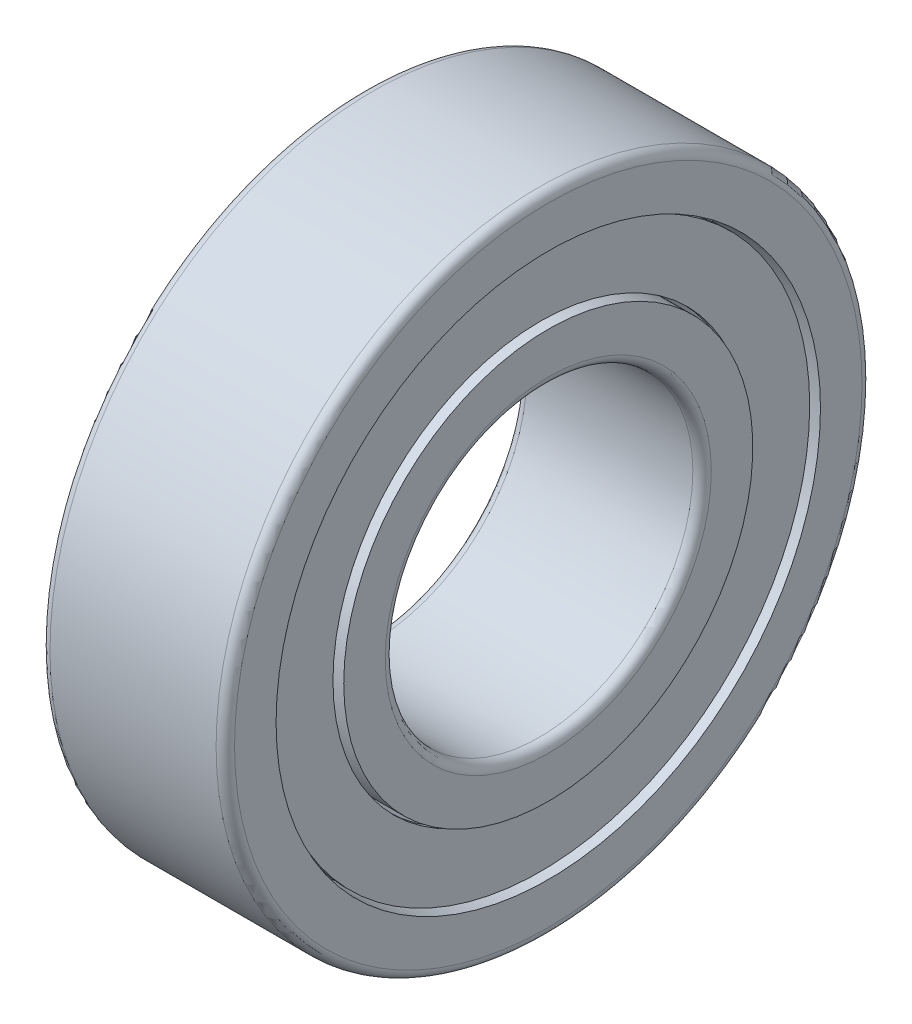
SolidWorks part; units mm, degrees
ref_plane "Plan de face" through (0, 0, 0) normal (0, 0, 1) x (1, 0, 0)
ref_plane "Plan de dessus" through (0, 0, 0) normal (0, 1, 0) x (1, 0, 0)
ref_plane "Plan de droite" through (0, 0, 0) normal (1, 0, 0) x (0, 0, -1)
imported_body "BAGUE INTERIEUR"
imported_body "BAGUE EXTERIEUR"
sketch "Esquisse2" plane through (0, 0, 0) normal (0, 0, 1) x (1, 0, 0)
  line L0 (0, 0) -> (14.2169, 0) construction
  line L1 (3.5403, 17.7) -> (0, 17.7) construction
  line L2 (0.5, 17.5) -> (0.8, 17.5)
  line L3 (0.5, 17.5) -> (0.5, 13.5)
  line L4 (0.5, 13.5) -> (0.8, 13.5)
  line L5 (0.8, 17.5) -> (0.8, 13.5)
  line L6 (11.2, 17.5) -> (11.5, 17.5)
  line L7 (11.2, 17.5) -> (11.2, 13.5)
  line L8 (11.2, 13.5) -> (11.5, 13.5)
  line L9 (11.5, 17.5) -> (11.5, 13.5)
  line L11 (0, 20.4) -> (0, -20.4) construction
  line L12 (12, -20.4) -> (12, 20.4) construction
  line L13 (3.5403, 13.3) -> (0, 13.3) construction
  dimension "D1" = 0.3
  dimension "D2" = 0.2
  dimension "D3" = 0.2
  dimension "D4" = 0.5
  dimension "D5" = 0.5
revolve "JOINTS" add sketch "Esquisse2" angle 360 about L0
sketch "Esquisse3" plane through (0, 0, 0) normal (0, 0, 1) x (1, 0, 0)
  line L0 (0, 0) -> (15.5518, 0) construction
  circle A0 centre (6, 15.5) radius 3.25
  circle A1 centre (6, 15.5) radius 3.3
  arc A2 (8.4597, 17.7) -> (3.5403, 17.7) centre (6, 15.5) ccw construction
  dimension "D1" = 0.05
revolve "Révolution1" add sketch "Esquisse3" angle 360 about L0
